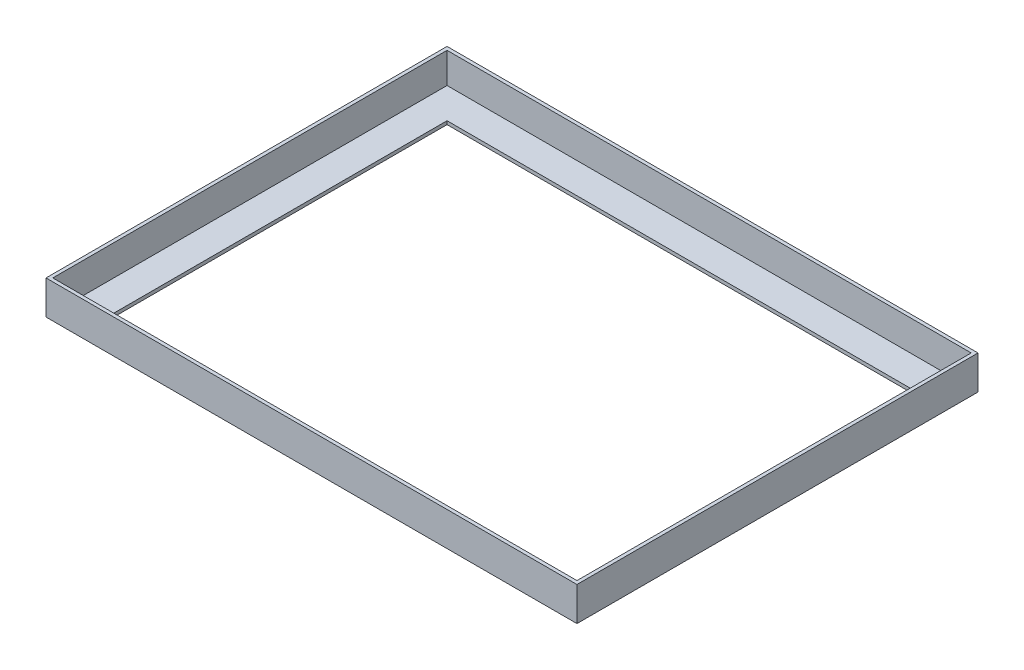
SolidWorks part; units mm, degrees
ref_plane "Front Plane" through (0, 0, 0) normal (0, 0, 1) x (1, 0, 0)
ref_plane "Top Plane" through (0, 0, 0) normal (0, 1, 0) x (1, 0, 0)
ref_plane "Right Plane" through (0, 0, 0) normal (1, 0, 0) x (0, 0, -1)
sketch "Sketch1" plane through (0, 0, 0) normal (0, 1, 0) x (1, 0, 0)
  line L0 (-205, 147.5) -> (-205, -147.5)
  line L1 (-235, 177.5) -> (235, 177.5)
  line L2 (-235, 177.5) -> (-235, -177.5)
  line L3 (-235, -177.5) -> (235, -177.5)
  line L4 (235, 177.5) -> (235, -177.5)
  line L5 (-235, 177.5) -> (235, -177.5) construction
  line L6 (-235, -177.5) -> (235, 177.5) construction
  line L7 (-205, -147.5) -> (205, -147.5)
  line L8 (205, 147.5) -> (205, -147.5)
  line L9 (-205, 147.5) -> (205, 147.5)
  point P0 (0, 0)
  dimension "D1" = 470
  dimension "D2" = 355
  dimension "D3" = 30
extrude "Boss-Extrude1" add sketch "Sketch1" along normal blind 3
sketch "Sketch2" plane through (0, 3, 0) normal (0, 1, 0) x (1, 0, 0)
  line L0 (-235, -177.5) -> (235, -177.5) construction
  line L1 (-235, 177.5) -> (-235, -177.5) construction
  line L2 (235, 177.5) -> (-235, 177.5) construction
  line L3 (235, -177.5) -> (235, 177.5) construction
  line L4 (-235, -177.5) -> (235, -177.5)
  line L5 (235, -177.5) -> (235, 177.5)
  line L6 (235, 177.5) -> (-235, 177.5)
  line L7 (-235, 177.5) -> (-235, -177.5)
  line L8 (-232, -174.5) -> (232, -174.5)
  line L9 (232, -174.5) -> (232, 174.5)
  line L10 (232, 174.5) -> (-232, 174.5)
  line L11 (-232, 174.5) -> (-232, -174.5)
  dimension "D1" = 3
extrude "Boss-Extrude2" add sketch "Sketch2" along normal blind 27
